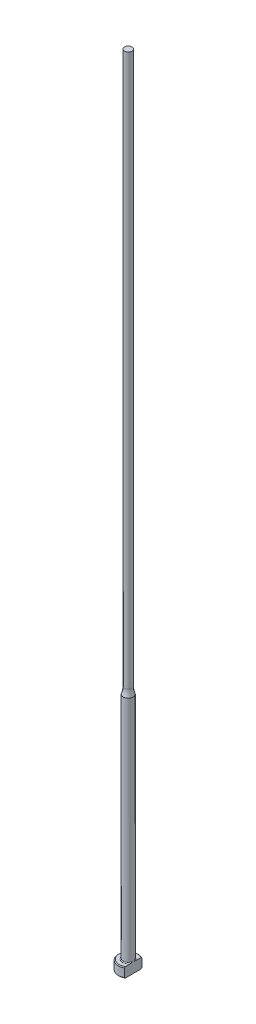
SolidWorks part; units mm, degrees
ref_plane "Front Plane" through (0, 0, 0) normal (0, 0, 1) x (1, 0, 0)
ref_plane "Top Plane" through (0, 0, 0) normal (0, 1, 0) x (1, 0, 0)
ref_plane "Right Plane" through (0, 0, 0) normal (1, 0, 0) x (0, 0, -1)
sketch "Sketch1" plane through (0, 0, 0) normal (0, 0, 1) x (1, 0, 0)
  line L0 (0, 259.9588) -> (0, -15.1925) construction
  line L1 (0, 0) -> (-3.175, 0)
  line L2 (-3.175, 0) -> (-3.175, 3.175)
  line L3 (-3.175, 3.175) -> (-1.5875, 3.175)
  line L4 (-1.19, 78.4114) -> (-1.19, 254)
  line L5 (-1.19, 254) -> (0, 254)
  line L6 (0, 254) -> (0, 0)
  line L7 (-1.5875, 3.175) -> (-1.5875, 76.2)
  arc A0 (-1.5875, 76.2) -> (-1.19, 78.4114) centre (-7.54, 78.4114) ccw
  point P13 (-1.5875, 0)
  dimension "D1" = 6.35
  dimension "L" = 254
  dimension "D2" = 3.175
  dimension "H" = 6.35
  dimension "T" = 3.175
  dimension "D" = 2.38
  dimension "S" = 76.2
revolve "Revolve1" add sketch "Sketch1" angle 360 about L0
chamfer "Chamfer1" distance 0.254 angle 45 2 edges at (0, 3.175, 3.175) (0, 0, 3.175)
fillet "Fillet1" radius 0.254 1 edges at (0, 3.175, 1.5875)
sketch "Sketch2" plane through (0, 0, 0) normal (0, 1, 0) x (1, 0, 0)
  line L0 (1.5875, -2.7496) -> (1.5875, 2.7496)
  circle A0 centre (0, 0) radius 3.175 construction
  arc A2 (1.5875, -2.7496) -> (1.5875, 2.7496) centre (0, 0) ccw
  circle A3 centre (0, 0) radius 3.175 construction
  circle A4 centre (0, 0) radius 1.5875 construction
extrude "Key Head" cut sketch "Sketch2" along normal up to next
